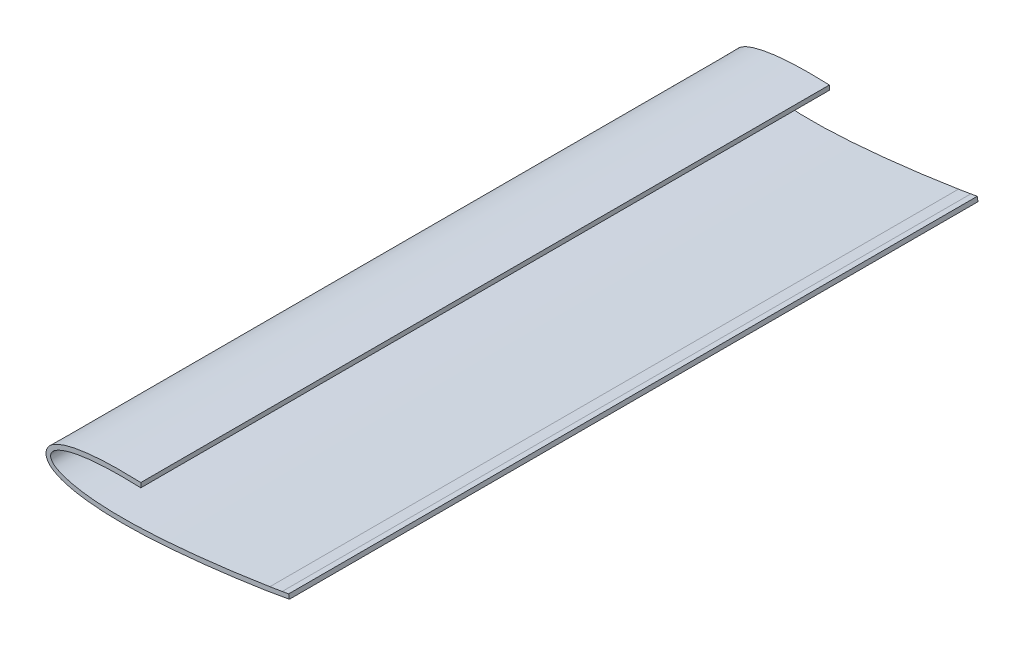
SolidWorks part; units mm, degrees
ref_plane "Alzado" through (0, 0, 0) normal (0, 0, 1) x (1, 0, 0)
ref_plane "Planta" through (0, 0, 0) normal (0, 1, 0) x (1, 0, 0)
ref_plane "Vista lateral" through (0, 0, 0) normal (1, 0, 0) x (0, 0, -1)
sketch "Croquis1" plane through (0, 0, 0) normal (0, 0, 1) x (1, 0, 0)
  line L3 (-51.8452, -1.0193) -> (-51.8452, 10.7369) construction
  line L7 (-12.5457, 8.6593) -> (-12.5457, 6.6578)
  line L8 (42.0512, -4.7997) -> (52.1883, -3.0252)
  line L9 (52.1883, -3.0252) -> (51.8586, -1.1415)
  line L10 (43.6919, -2.5183) -> (49.0637, -1.6205)
  spline S0 degree 3 poles (49.0637, -1.6205) (49.9955, -1.462) (50.927, -1.3018) (51.8586, -1.1415) knots 0.986199 0.986199 0.986199 0.986199 1 1 1 1
  spline S1 degree 3 poles (-12.5457, 6.6578) (-15.2877, 6.7668) (-19.7576, 6.8709) (-25.9559, 6.7942) (-31.1392, 6.5446) (-36.33, 6.0583) (-40.6517, 5.3737) (-44.1036, 4.5576) (-46.7247, 3.7381) (-48.9287, 2.7422) (-50.9076, 1.4233) (-52.4444, -0.8934) (-50.9135, -3.2139) (-48.9379, -4.5378) (-46.7365, -5.5393) (-44.1174, -6.3654) (-40.6676, -7.1903) (-36.3476, -7.8858) (-31.1581, -8.3852) (-25.9754, -8.6479) (-19.0686, -8.7508) (-10.4312, -8.5226) (-0.0742, -7.8564) (10.2814, -6.9133) (20.6372, -5.7565) (30.9943, -4.4209) (38.6767, -3.3033) (42.9078, -2.6426) (43.6919, -2.5183) knots 0.304212 0.304212 0.304212 0.304212 0.342904 0.367241 0.391608 0.416059 0.440726 0.453243 0.466028 0.479473 0.486972 0.5 0.513028 0.520527 0.533972 0.546757 0.559274 0.583941 0.608392 0.632759 0.657096 0.705781 0.75455 0.803422 0.852398 0.901478 0.95067 0.961864 0.961864 0.961864 0.961864
  spline S2 degree 3 poles (-12.5457, 8.6593) (-14.2008, 8.7245) (-17.9859, 8.8362) (-23.9117, 8.8533) (-29.2612, 8.6594) (-33.5466, 8.3334) (-36.7638, 7.9848) (-39.9863, 7.5064) (-42.6697, 6.9654) (-44.8118, 6.4164) (-46.4242, 5.9271) (-48.0377, 5.3321) (-49.3868, 4.7097) (-50.4203, 4.1328) (-51.2376, 3.6056) (-52.0796, 2.9014) (-52.8513, 2.0211) (-53.4943, 0.9465) (-53.8355, -0.1564) (-53.8623, -1.1847) (-53.705, -2.1403) (-53.278, -3.1629) (-52.5811, -4.1586) (-51.7758, -4.9782) (-50.9334, -5.6129) (-49.8835, -6.2511) (-48.5616, -6.913) (-46.9433, -7.5553) (-45.3314, -8.0785) (-43.1908, -8.6608) (-40.5097, -9.2343) (-37.2878, -9.7449) (-34.0714, -10.1196) (-30.857, -10.3871) (-26.5758, -10.6268) (-21.2336, -10.7369) (-14.8423, -10.6494) (-8.4674, -10.3869) (-2.11, -9.9868) (6.3453, -9.3052) (16.8828, -8.2256) (29.4864, -6.6572) (37.8675, -5.4476) (42.0512, -4.7997) knots 0.304582 0.304582 0.304582 0.304582 0.32775 0.357505 0.38726 0.402137 0.417015 0.431892 0.44677 0.454208 0.461647 0.469086 0.476525 0.480244 0.483963 0.487683 0.491402 0.495121 0.498841 0.5007 0.50256 0.506279 0.509999 0.513718 0.517437 0.521157 0.528596 0.536034 0.543473 0.550912 0.565789 0.580667 0.595544 0.610421 0.625299 0.655054 0.684809 0.714563 0.744318 0.774073 0.833583 0.893092 0.952602 0.952602 0.952602 0.952602
extrude "Saliente-Extruir1" add sketch "Croquis1" along normal blind 300
